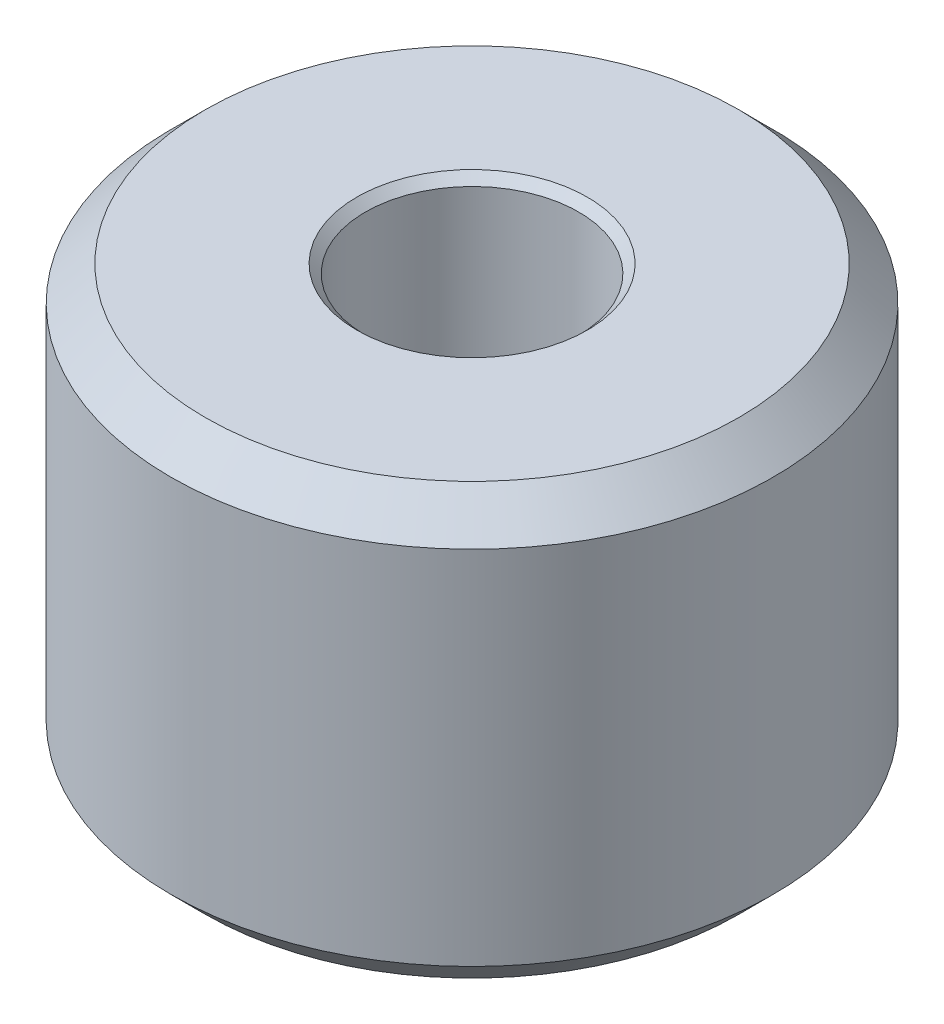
SolidWorks part; units mm, degrees
ref_plane "Plan de face" through (0, 0, 0) normal (0, 0, 1) x (1, 0, 0)
ref_plane "Plan de dessus" through (0, 0, 0) normal (0, 1, 0) x (1, 0, 0)
ref_plane "Plan de droite" through (0, 0, 0) normal (1, 0, 0) x (0, 0, -1)
sketch "Esquisse1" plane through (0, 0, 0) normal (0, 1, 0) x (1, 0, 0)
  circle A0 centre (0, 0) radius 17.5
  dimension "D1" = 35
extrude "Boss.-Extru.1" add sketch "Esquisse1" along normal blind 25
chamfer "Chanfrein1" distance 2 angle 45 2 edges at (0, 0, 17.5) (0, 25, 17.5)
sketch "Esquisse2" plane through (0, 25, 0) normal (0, 1, 0) x (1, 0, 0)
  circle A0 centre (0, 0) radius 6.2
  dimension "D1" = 12.4
extrude "Enlèv. mat.-Extru.1" cut sketch "Esquisse2" against normal blind 26.7
chamfer "Chanfrein2" distance 0.5 angle 45 2 edges at (0, 25, 6.2) (0, 0, 6.2)
